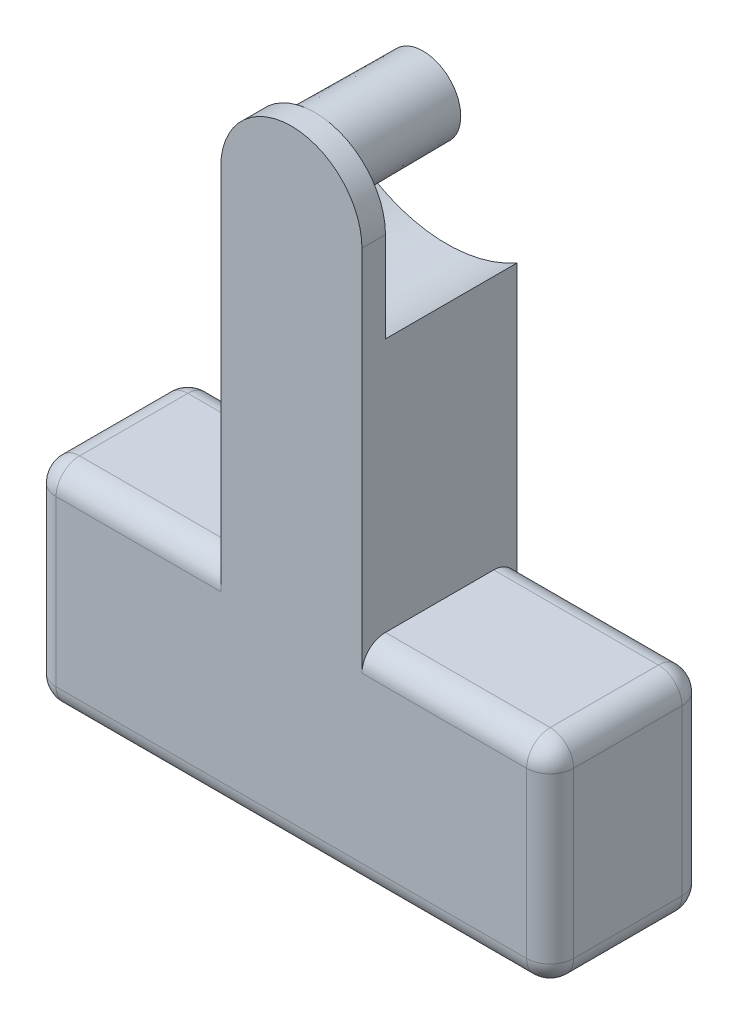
SolidWorks part; units mm, degrees
ref_plane "Front Plane" through (0, 0, 0) normal (0, 0, 1) x (1, 0, 0)
ref_plane "Top Plane" through (0, 0, 0) normal (0, 1, 0) x (1, 0, 0)
ref_plane "Right Plane" through (0, 0, 0) normal (1, 0, 0) x (0, 0, -1)
other "Center of Mass"
sketch "Sketch1" plane through (0, 0, 0) normal (0, 0, 1) x (1, 0, 0)
  circle A0 centre (0, 0) radius 8
  dimension "D1" = 16
extrude "Boss-Extrude1" add sketch "Sketch1" along normal mid plane 23
draft "Draft1" type of draft neutral plane draft angle 0.5 faces to draft 1 parameters "D1"=0.5
sketch "Sketch2" plane through (0, 0, 11.5) normal (0, 0, 1) x (1, 0, 0)
  line L0 (-15, -6.7993) -> (-15, -80)
  line L2 (15, -80) -> (15, -6.7993)
  line L3 (-15, -80) -> (-55, -80)
  line L4 (55, -125) -> (-55, -125)
  line L5 (55, -125) -> (55, -80)
  line L6 (55, -80) -> (15, -80)
  line L7 (-55, -125) -> (-55, -80)
  arc A0 (15, -6.7993) -> (-15, -6.7993) centre (0, -6.7993) ccw
  circle A1 centre (0, 0) radius 8.2007 construction
  dimension "D1" = 30
  dimension "D2" = 125
  dimension "D3" = 40
  dimension "D4" = 40
  dimension "D5" = 45
extrude "Boss-Extrude3" add sketch "Sketch2" along normal blind 5
sketch "Sketch4" plane through (0, 0, 11.5) normal (0, 0, -1) x (-1, 0, 0)
  line L1 (-55, -125) -> (55, -125)
  line L2 (-55, -125) -> (-55, -80)
  line L3 (-55, -80) -> (55, -80)
  line L4 (55, -125) -> (55, -80)
  line L5 (-15, -80) -> (15, -80)
  line L6 (-15, -80) -> (-15, -25.9808)
  line L8 (15, -80) -> (15, -25.9808)
  line L9 (15, -6.7993) -> (15, -80) construction
  arc A0 (-15, -25.9808) -> (15, -25.9808) centre (0, 0) ccw
  circle A1 centre (0, 0) radius 8.2007 construction
  dimension "D1" = 60
extrude "Boss-Extrude4" add sketch "Sketch4" along normal offset from surface (28 mm away) 5 contours A0 L3 M5 M11 | L3 M6 M7 M8 M9 M10
fillet "Fillet2" radius 5 14 edges at (0, -125, -16.5) (-35, -80, 16.5) (35, -80, 16.5) (35, -80, -16.5) (-35, -80, -16.5) (55, -125, 0) (55, -102.5, -16.5) (-55, -102.5, -16.5) (55, -80, 0) (55, -102.5, 16.5) (0, -125, 16.5) (-55, -125, 0) (-55, -80, 0) (-55, -102.5, 16.5)
